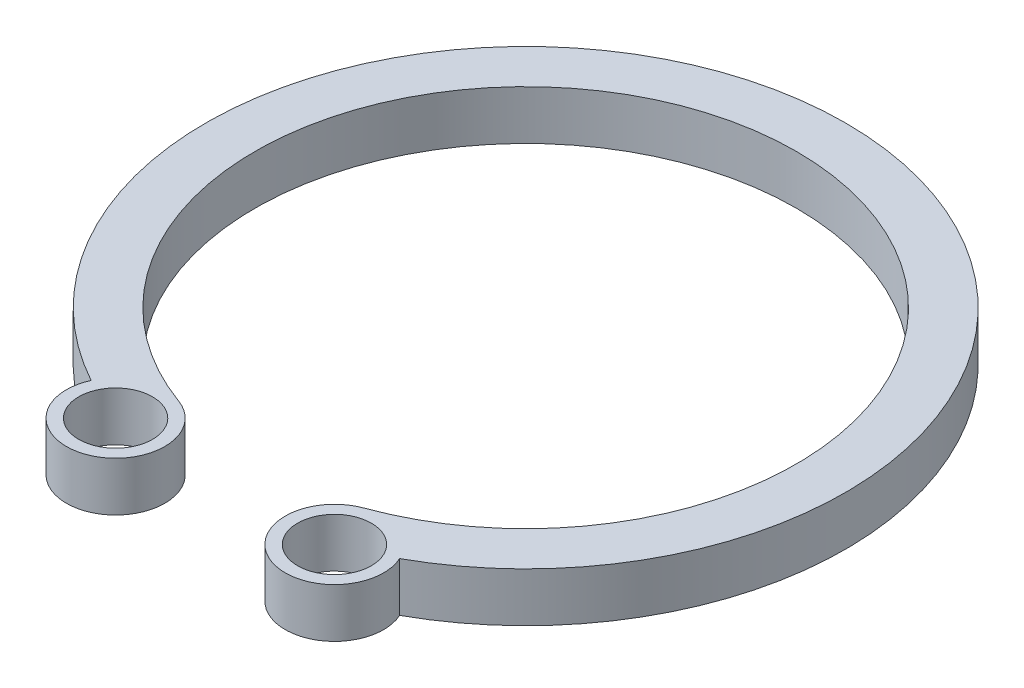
SolidWorks part; units mm, degrees
ref_plane "Спереди" through (0, 0, 0) normal (0, 0, 1) x (1, 0, 0)
ref_plane "Сверху" through (0, 0, 0) normal (0, 1, 0) x (1, 0, 0)
ref_plane "Справа" through (0, 0, 0) normal (1, 0, 0) x (0, 0, -1)
sketch "Эскиз1" plane through (0, 0, 0) normal (0, 1, 0) x (1, 0, 0)
  line L0 (0, 0) -> (0, -11.4621) construction
  line L1 (0, 0) -> (3.8497, -10.5769) construction
  line L2 (0, 0) -> (-3.3177, -9.1154) construction
  arc A0 (3.1337, -5.6947) -> (-3.1337, -5.6947) centre (0, 0) ccw
  arc A1 (1.8811, -5.1683) -> (-1.8811, -5.1683) centre (0, 0) ccw
  arc A2 (-3.1337, -5.6947) -> (-1.8811, -5.1683) centre (-2.2231, -6.108) ccw
  arc A3 (1.8811, -5.1683) -> (3.1337, -5.6947) centre (2.2231, -6.108) ccw
  circle A4 centre (-2.2231, -6.108) radius 0.75
  circle A5 centre (2.2231, -6.108) radius 0.75
  dimension "D1" = 13
  dimension "D2" = 11
  dimension "D3" = 1.5
  dimension "D4" = 1
extrude "Бобышка-Вытянуть1" add sketch "Эскиз1" along normal blind 1
